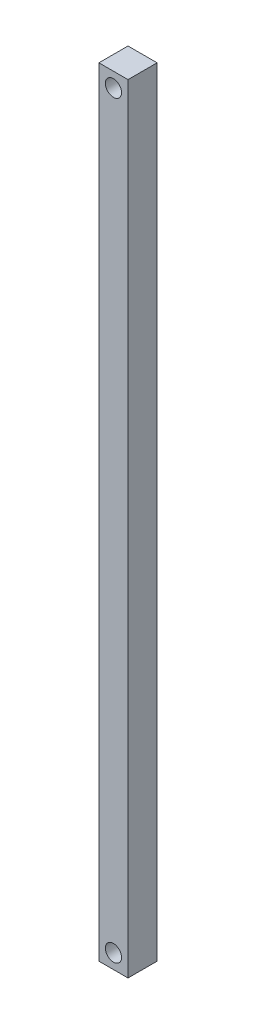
SolidWorks part; units mm, degrees
ref_plane "Front Plane" through (0, 0, 0) normal (0, 0, 1) x (1, 0, 0)
ref_plane "Top Plane" through (0, 0, 0) normal (0, 1, 0) x (1, 0, 0)
ref_plane "Right Plane" through (0, 0, 0) normal (1, 0, 0) x (0, 0, -1)
sketch "Sketch1" plane through (0, 0, 0) normal (0, 0, 1) x (1, 0, 0)
  line L0 (55, 0) -> (-55, 0) construction
  line L1 (-3.7697, 0) -> (14.9303, 0)
  line L2 (-3.7697, 0) -> (-3.7697, 500)
  line L3 (-3.7697, 500) -> (14.9303, 500)
  line L4 (14.9303, 0) -> (14.9303, 500)
  line L5 (5.5803, 500) -> (5.5803, 0) construction
  circle A0 centre (5.5803, 490.65) radius 5.2
  circle A1 centre (5.5803, 9.35) radius 5.2
  dimension "D3" = 10.4
  dimension "D1" = 18.7
  dimension "D2" = 500
  dimension "D4" = 9.35
  dimension "D6" = 9.35
extrude "Boss-Extrude1" add sketch "Sketch1" along normal blind 18.7
